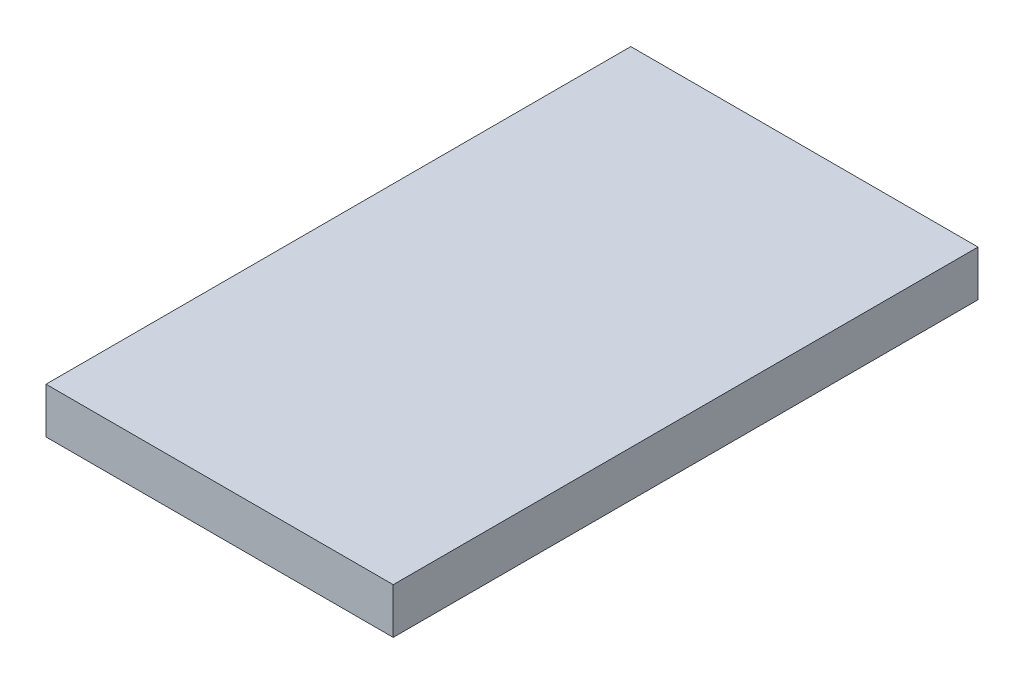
SolidWorks part; units mm, degrees
ref_plane "Plan de face" through (0, 0, 0) normal (0, 0, 1) x (1, 0, 0)
ref_plane "Plan de dessus" through (0, 0, 0) normal (0, 1, 0) x (1, 0, 0)
ref_plane "Plan de droite" through (0, 0, 0) normal (1, 0, 0) x (0, 0, -1)
sketch "Esquisse1" plane through (0, 0, 0) normal (0, 1, 0) x (1, 0, 0)
  line L1 (-19, 32) -> (19, 32)
  line L2 (-19, 32) -> (-19, -32)
  line L3 (-19, -32) -> (19, -32)
  line L4 (19, 32) -> (19, -32)
  line L5 (-19, 32) -> (19, -32) construction
  line L6 (-19, -32) -> (19, 32) construction
  point P0 (0, 0)
extrude "Boss.-Extru.1" add sketch "Esquisse1" along normal blind 5
